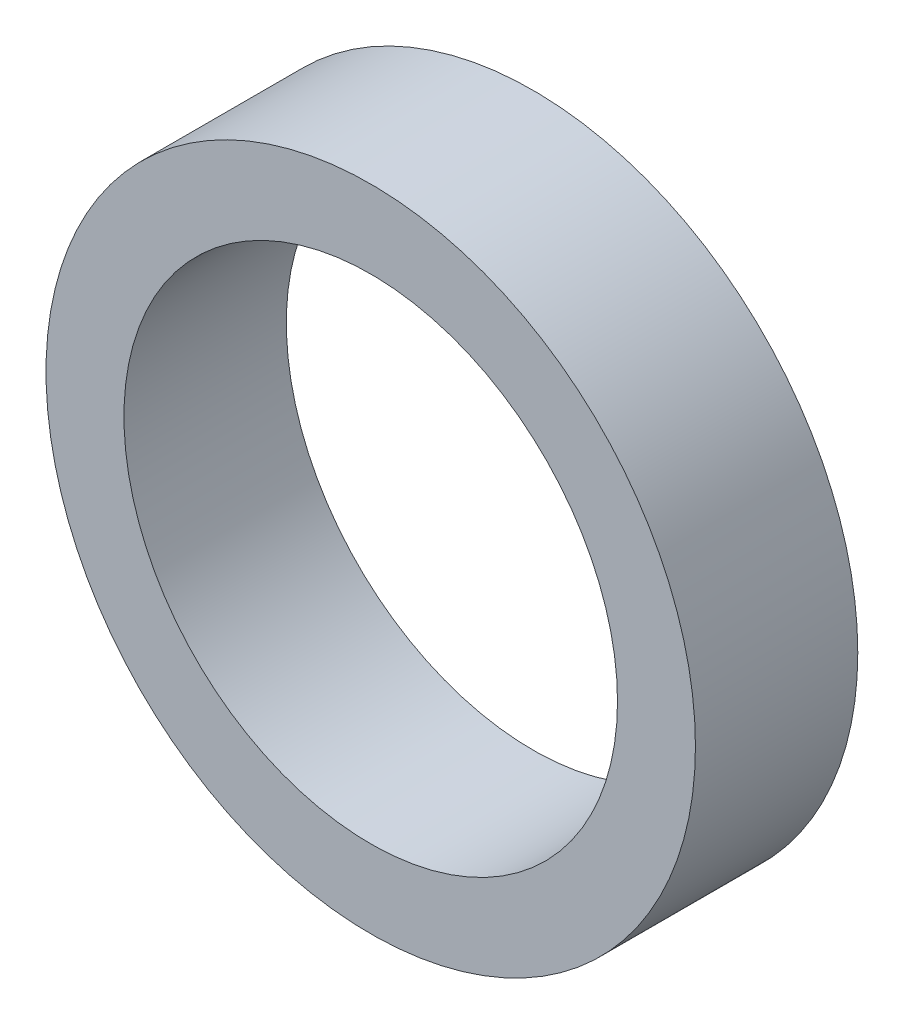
SolidWorks part; units mm, degrees
ref_plane "Plan de face" through (0, 0, 0) normal (0, 0, 1) x (1, 0, 0)
ref_plane "Plan de dessus" through (0, 0, 0) normal (0, 1, 0) x (1, 0, 0)
ref_plane "Plan de droite" through (0, 0, 0) normal (1, 0, 0) x (0, 0, -1)
sketch "Esquisse1" plane through (0, 0, 0) normal (0, 0, 1) x (1, 0, 0)
  circle A0 centre (0, 0) radius 10
  circle A1 centre (0, 0) radius 7.6
  dimension "D1" = 20
  dimension "D2" = 15.2
extrude "Extrusion1" add sketch "Esquisse1" along normal blind 5
